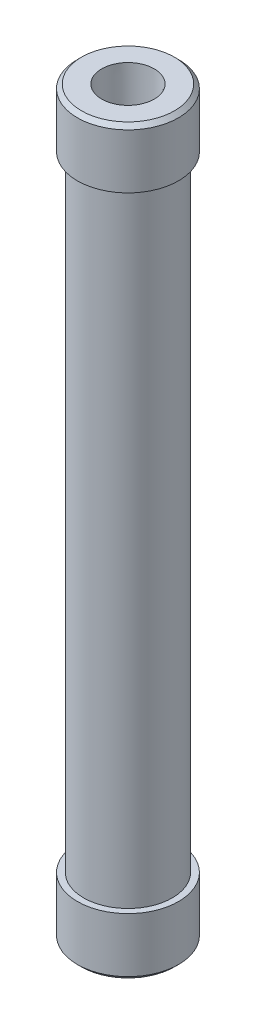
SolidWorks part; units mm, degrees
ref_plane "Front Plane" through (0, 0, 0) normal (0, 0, 1) x (1, 0, 0)
ref_plane "Top Plane" through (0, 0, 0) normal (0, 1, 0) x (1, 0, 0)
ref_plane "Right Plane" through (0, 0, 0) normal (1, 0, 0) x (0, 0, -1)
sketch "Sketch1" plane through (0, 0, 0) normal (0, 1, 0) x (1, 0, 0)
  circle A0 centre (0, 0) radius 16.7005
  circle A1 centre (0, 0) radius 13.1445
  dimension "D1" = 33.401
  dimension "D2" = 3.556
extrude "Boss-Extrude1" add sketch "Sketch1" along normal blind 279.4
sketch "Sketch2" plane through (0, 0, 0) normal (0, 1, 0) x (1, 0, 0)
  circle A0 centre (0, 0) radius 19.05
  dimension "D1" = 38.1
extrude "Boss-Extrude2" add sketch "Sketch2" along normal blind 22.098
ref_plane "Plane1" through (0, 279.4, 0) normal (0, 1, 0) x (1, 0, 0)
sketch "Sketch3" plane through (0, 279.4, 0) normal (0, 1, 0) x (1, 0, 0)
  circle A0 centre (0, 0) radius 19.05
  dimension "D1" = 38.1
extrude "Boss-Extrude3" add sketch "Sketch3" against normal blind 22.098
chamfer "Chamfer1" distance 1.524 angle 45 2 edges at (0, 0, 19.05) (0, 279.4, 19.05)
hole_wizard "1/2 Rc Tapped Hole1" positions "Sketch6" profile "Sketch5" size "1/2" standard "BSI"
sketch "Sketch6" plane through (0, 0, 0) normal (0, -1, 0) x (-1, 0, 0)
  point P0 (0, 0)
sketch "Sketch5" plane through (0, 0, 0) normal (1, 0, 0) x (0, 0, -1)
  line L0 (0, 0) -> (0, 29.3875)
  line L1 (8.75, 24.13) -> (0, 29.3875)
  line L2 (-8.75, 24.13) -> (0, 29.3875) construction
  line L3 (8.75, 24.13) -> (8.75, 14.986)
  line L4 (8.75, 14.986) -> (9.4283, 14.986)
  line L5 (9.4283, 14.986) -> (9.8961, 0)
  line L6 (-9.4283, 14.986) -> (-9.8961, 0) construction
  line L7 (9.8961, 0) -> (0, 0)
  line L8 (0, -6.35) -> (0, 107.95) construction
  line L11 (-8.75, 14.986) -> (-9.4283, 14.986) construction
  dimension "Tap Drill Dia." = 17.5
  dimension "Tap Drill Depth" = 24.13
  dimension "Thread Dia." = 19.7921
  dimension "Thread Angle" = 3.576
  dimension "Thread Depth" = 14.986
  dimension "Drill Angle" = 118
hole_wizard "1/2 Rc Tapped Hole2" positions "Sketch8" profile "Sketch7" size "1/2" standard "BSI"
sketch "Sketch8" plane through (0, 279.4, 0) normal (0, 1, 0) x (1, 0, 0)
  point P0 (0, 0)
sketch "Sketch7" plane through (0, 279.4, 0) normal (1, 0, 0) x (0, 0, 1)
  line L0 (0, 0) -> (0, 29.3875)
  line L1 (8.75, 24.13) -> (0, 29.3875)
  line L2 (-8.75, 24.13) -> (0, 29.3875) construction
  line L3 (8.75, 24.13) -> (8.75, 14.986)
  line L4 (8.75, 14.986) -> (9.4283, 14.986)
  line L5 (9.4283, 14.986) -> (9.8961, 0)
  line L6 (-9.4283, 14.986) -> (-9.8961, 0) construction
  line L7 (9.8961, 0) -> (0, 0)
  line L8 (0, -6.35) -> (0, 107.95) construction
  line L11 (-8.75, 14.986) -> (-9.4283, 14.986) construction
  dimension "Tap Drill Dia." = 17.5
  dimension "Tap Drill Depth" = 24.13
  dimension "Thread Dia." = 19.7921
  dimension "Thread Angle" = 3.576
  dimension "Thread Depth" = 14.986
  dimension "Drill Angle" = 118
